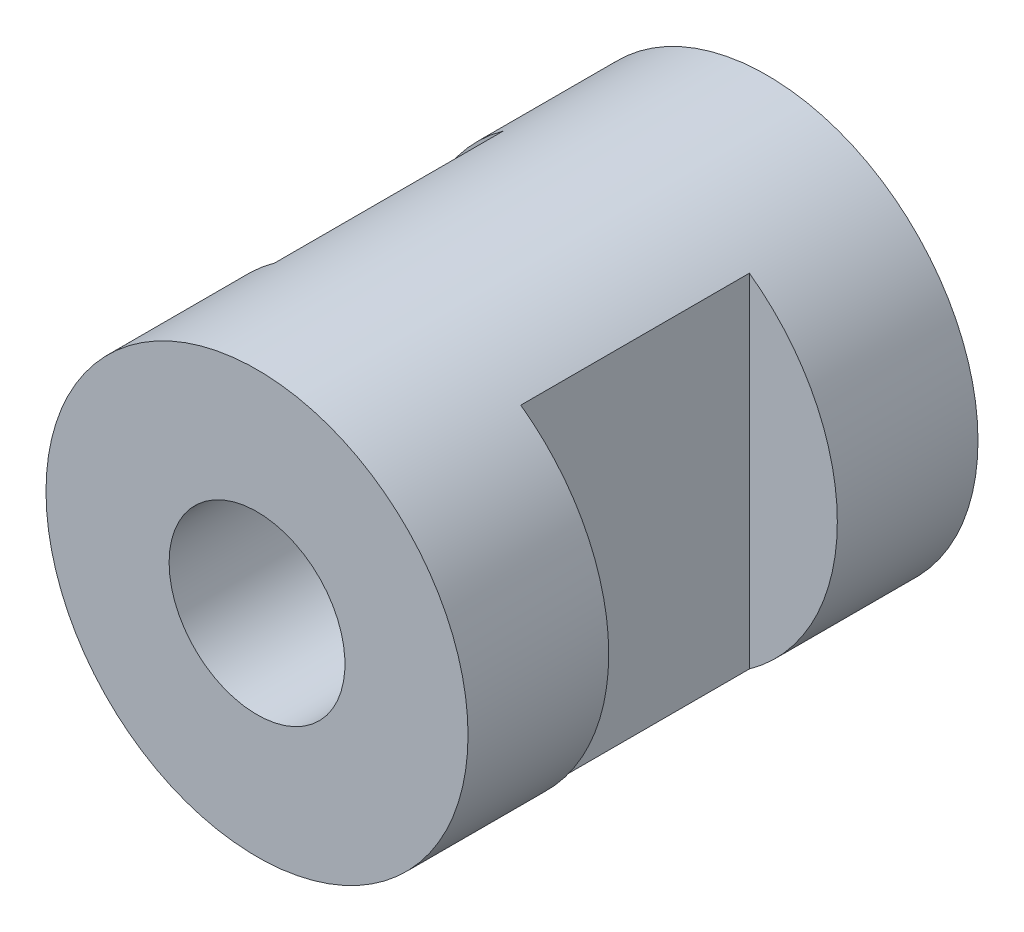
SolidWorks part; units mm, degrees
ref_plane "前视基准面" through (0, 0, 0) normal (0, 0, 1) x (1, 0, 0)
ref_plane "上视基准面" through (0, 0, 0) normal (0, 1, 0) x (1, 0, 0)
ref_plane "右视基准面" through (0, 0, 0) normal (1, 0, 0) x (0, 0, -1)
sketch "草图1" plane through (0, 0, 0) normal (0, 0, 1) x (1, 0, 0)
  circle A0 centre (0, 0) radius 6
extrude "凸台-拉伸1" add sketch "草图1" along normal blind 14.5
ref_plane "基准面1" through (0, 10, 0) normal (0, 1, 0) x (-1, 0, 0)
sketch "草图2" plane through (0, 10, 0) normal (0, 1, 0) x (-1, 0, 0)
  line L0 (-6, 14.5) -> (-6, 0) construction
  line L1 (-6.7564, 10.5) -> (-3.5, 10.5)
  line L2 (-6.7564, 10.5) -> (-6.7564, 4)
  line L3 (-6.7564, 4) -> (-3.5, 4)
  line L4 (-3.5, 10.5) -> (-3.5, 4)
  line L5 (0, 14.5) -> (0, 0) construction
  line L6 (6, 14.5) -> (-6, 14.5) construction
  line L7 (0, 7.25) -> (5.9851, 7.25) construction
  line L8 (6.7564, 10.5) -> (6.7564, 4)
  line L9 (6.7564, 4) -> (3.5, 4)
  line L10 (3.5, 10.5) -> (3.5, 4)
  line L11 (6.7564, 10.5) -> (3.5, 10.5)
  dimension "D1" = 2.5
  dimension "D2" = 6.5
extrude "切除-拉伸1" cut sketch "草图2" against normal through all
sketch "草图3" plane through (0, 0, 0) normal (0, 0, -1) x (-1, 0, 0)
  circle A0 centre (0, 0) radius 2.5
extrude "切除-拉伸2" cut sketch "草图3" against normal blind 14.5
